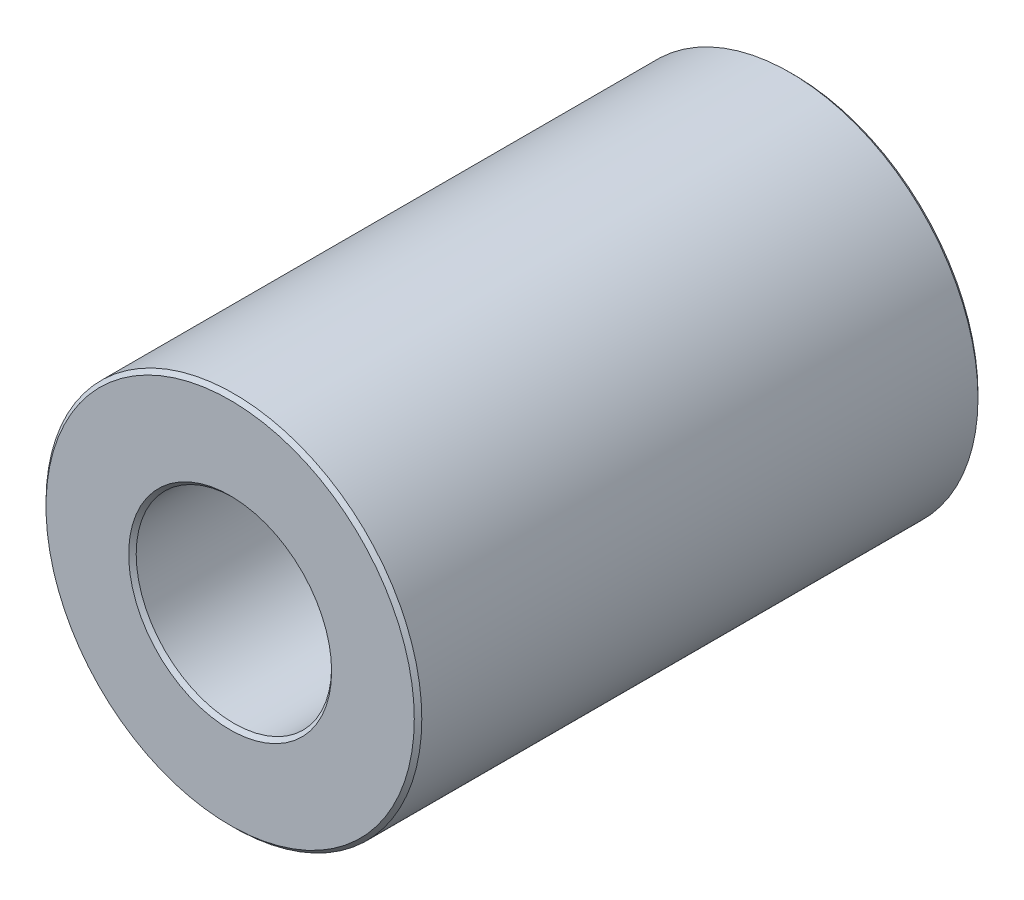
SolidWorks part; units mm, degrees
ref_plane "Front Plane" through (0, 0, 0) normal (0, 0, 1) x (1, 0, 0)
ref_plane "Top Plane" through (0, 0, 0) normal (0, 1, 0) x (1, 0, 0)
ref_plane "Right Plane" through (0, 0, 0) normal (1, 0, 0) x (0, 0, -1)
sketch "Sketch1" plane through (0, 0, 0) normal (0, 0, 1) x (1, 0, 0)
  circle A0 centre (0, 0) radius 5
  circle A1 centre (0, 0) radius 2.6
  dimension "D1" = 10
  dimension "D2" = 5.2
extrude "Boss-Extrude2" add sketch "Sketch1" along normal mid plane 15
chamfer "Chamfer3" distance 0.1 angle 45 4 edges at (5, 0, 7.5) (5, 0, -7.5) (2.6, 0, -7.5) (2.6, 0, 7.5)
